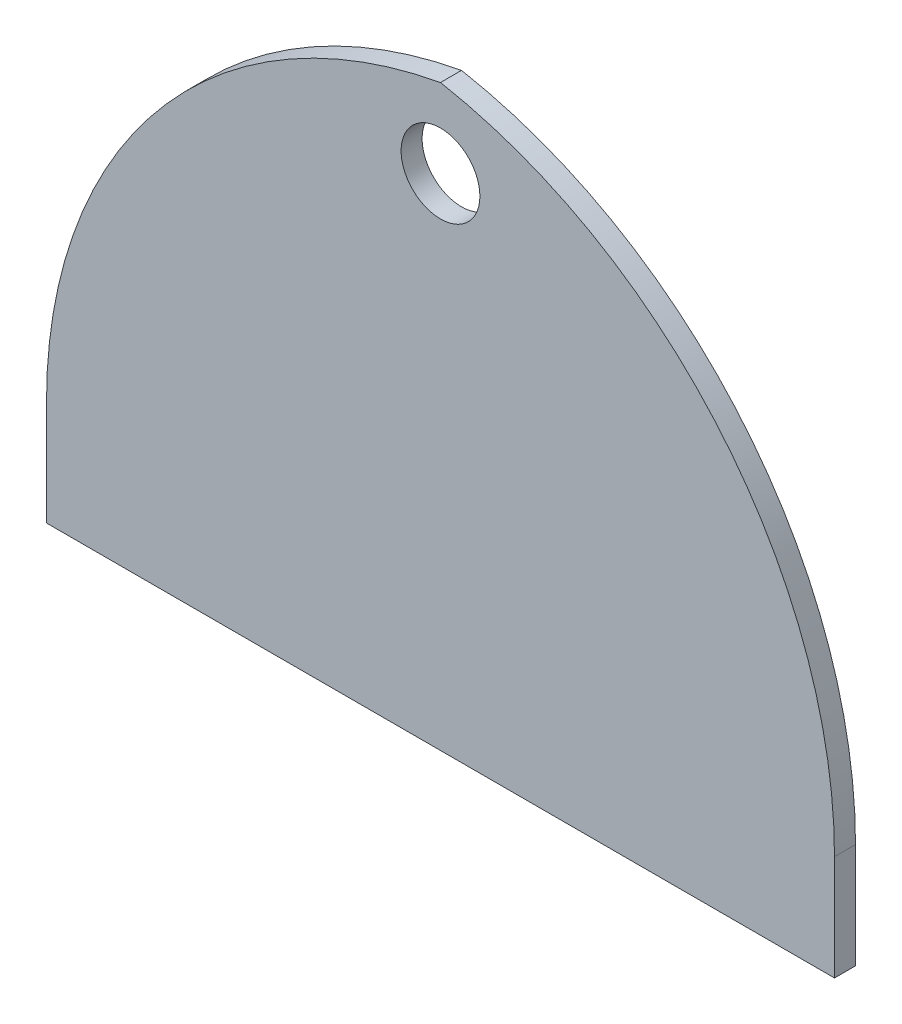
SolidWorks part; units mm, degrees
ref_plane "Alzado" through (0, 0, 0) normal (0, 0, 1) x (1, 0, 0)
ref_plane "Planta" through (0, 0, 0) normal (0, 1, 0) x (1, 0, 0)
ref_plane "Vista lateral" through (0, 0, 0) normal (1, 0, 0) x (0, 0, -1)
sketch "Croquis1" plane through (0, 0, 0) normal (0, 0, 1) x (1, 0, 0)
  line L0 (-1481.7014, -491.3706) -> (-1481.7014, -91.3706)
  line L1 (1518.2986, -491.3706) -> (-1481.7014, -491.3706)
  line L3 (1518.2986, -491.3706) -> (1518.2986, -91.3706)
  arc A0 (-1481.7014, -91.3706) -> (18.2986, 1711.158) centre (351.3351, -91.3706) cw
  arc A1 (1518.2986, -91.3706) -> (18.2986, 1711.158) centre (-314.7379, -91.3706) ccw
  circle A2 centre (18.2986, 1411.158) radius 150
  dimension "D3" = 300
  dimension "D2" = 300
  dimension "D1" = 3000
  dimension "D4" = 400
extrude "Saliente-Extruir1" add sketch "Croquis1" along normal blind 80
